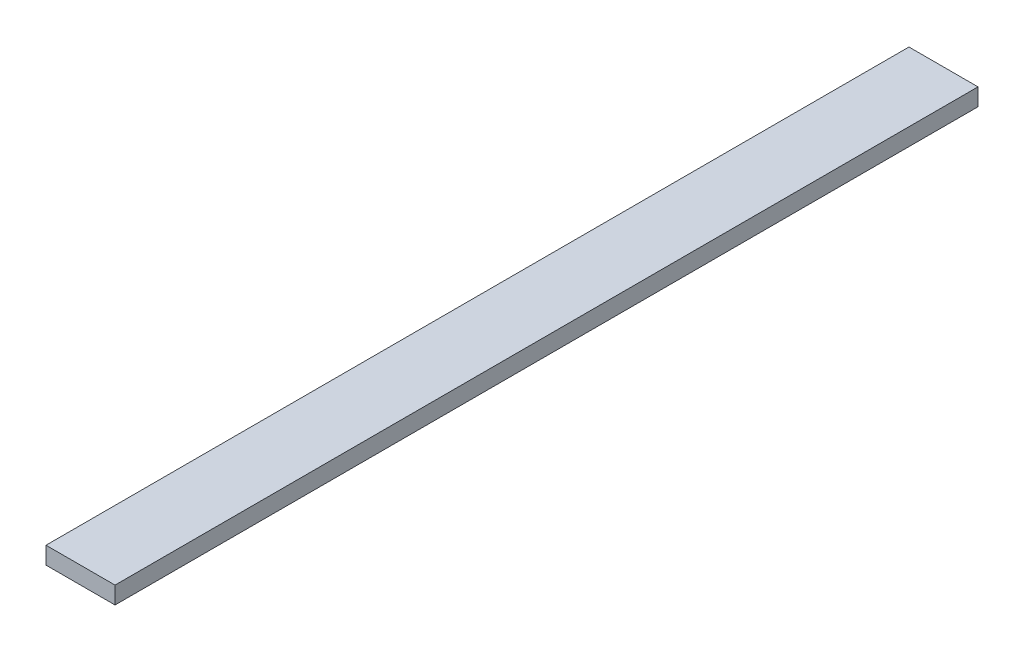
SolidWorks part; units mm, degrees
ref_plane "Face" through (0, 0, 0) normal (0, 0, 1) x (1, 0, 0)
ref_plane "Dessus" through (0, 0, 0) normal (0, 1, 0) x (1, 0, 0)
ref_plane "Droite" through (0, 0, 0) normal (1, 0, 0) x (0, 0, -1)
sketch "Esquisse1" plane through (0, 0, 0) normal (0, 0, 1) x (1, 0, 0)
  line L1 (0, 0) -> (8, 0)
  line L2 (0, 0) -> (0, 2)
  line L3 (0, 2) -> (8, 2)
  line L4 (8, 0) -> (8, 2)
  dimension "D1" = 8
  dimension "D2" = 2
extrude "Extrusion1" add sketch "Esquisse1" along normal blind 100
